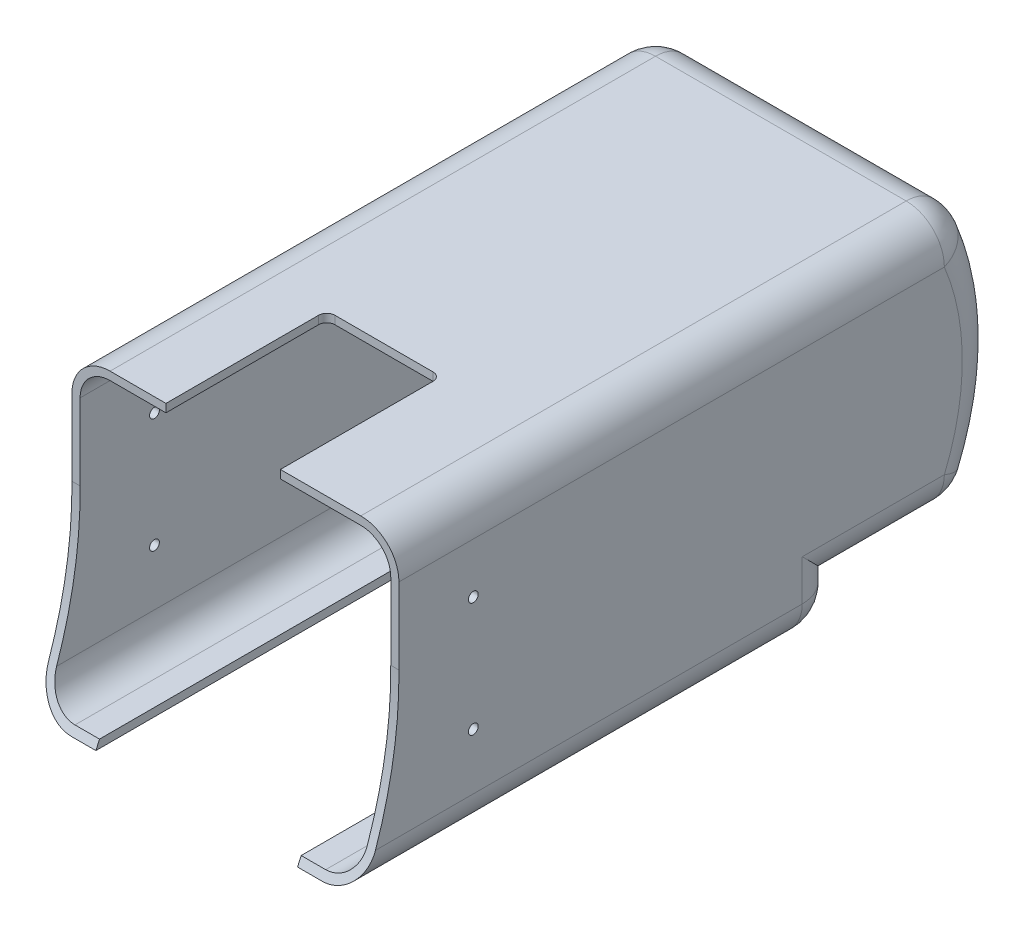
SolidWorks part; units mm, degrees
ref_plane "Front Plane" through (0, 0, 0) normal (0, 0, 1) x (1, 0, 0)
ref_plane "Top Plane" through (0, 0, 0) normal (0, 1, 0) x (1, 0, 0)
ref_plane "Right Plane" through (0, 0, 0) normal (1, 0, 0) x (0, 0, -1)
sketch "Sketch1" plane through (0, 0, 0) normal (0, 0, 1) x (1, 0, 0)
  line L3 (60, -54.5) -> (60, 54.5)
  line L4 (60, 54.5) -> (-60, 54.5)
  line L5 (-60, 54.5) -> (-60, -54.5)
  line L7 (-60, -54.5) -> (60, -54.5)
  line L8 (0, 0) -> (0, 54.5) construction
  line L9 (0, 0) -> (60, 0) construction
  dimension "D1" = 120
  dimension "D2" = 109
extrude "Boss-Extrude1" add sketch "Sketch1" against normal blind 193
sketch "Sketch11" plane through (60, 0, 0) normal (1, 0, 0) x (0, 0, -1)
  line L0 (0, 54.5) -> (-24.1876, 54.5)
  line L1 (0, -54.5) -> (-32.417, -54.5)
  line L4 (193, -54.5) -> (0, -54.5) construction
  line L7 (0, 54.5) -> (0, -54.5)
  line L8 (0, -54.5) -> (193, -54.5)
  line L9 (193, -54.5) -> (193, 54.5)
  line L10 (193, 54.5) -> (0, 54.5)
  line L11 (0, 54.5) -> (0, -54.5)
  arc A1 (-27.3008, -32.4552) -> (-27.3008, 54.4552) centre (-174, 11) ccw construction
  arc A2 (-32.417, -54.5) -> (-24.1876, 54.5) centre (-174, 11) ccw
  arc A3 (-24.4244, -33.3073) -> (-24.4244, 55.3073) centre (-174, 11) ccw construction
  dimension "D1" = 3
  dimension "D3" = 174
  dimension "D4" = 156
  dimension "D5" = 43.5
  dimension "D2" = 0
extrude "Boss-Extrude4" add sketch "Sketch11" against normal up to surface (120 mm away) contours L1 A2 L0 L11
sketch "Sketch2" plane through (60, 0, 0) normal (1, 0, 0) x (0, 0, -1)
  line L0 (193, -39.5) -> (146, -39.5)
  line L1 (193, -54.5) -> (193, 54.5) construction
  line L2 (146, -39.5) -> (146, -54.5)
  line L3 (193, -54.5) -> (-32.417, -54.5) construction
  line L4 (193, -39.5) -> (193, -54.5)
  line L5 (193, -54.5) -> (146, -54.5)
  dimension "D1" = 15
  dimension "D2" = 47
extrude "Cut-Extrude1" cut sketch "Sketch2" against normal through all
sketch "Sketch10" plane through (60, 0, 0) normal (1, 0, 0) x (0, 0, -1)
  line L1 (193, -39.5) -> (193, 54.5) construction
  line L2 (193, -39.5) -> (193, 54.5)
  arc A0 (193, 54.5) -> (193, -39.5) centre (104.7334, 7.5) cw
  dimension "D1" = 100
extrude "Boss-Extrude3" add sketch "Sketch10" against normal up to surface (120 mm away)
fillet "Fillet1" radius 14 13 edges at (60, -54.5, -56.7915) (-60, -54.5, -56.7915) (-60, 54.5, -84.4062) (60, 54.5, -84.4062) (60, -47, -146) (-60, -47, -146) (60, -39.5, -169.5) (-60, -39.5, -169.5) (0, -54.5, -146) (0, 54.5, -193) (-60, 7.5, -204.7334) (60, 7.5, -204.7334) (0, -39.5, -193)
shell "Shell1" thickness 3
sketch "Sketch8" plane through (0, -54.5, 0) normal (0, -1, 0) x (1, 0, 0)
  line L0 (-46, 32.417) -> (46, 32.417) construction
  line L1 (-37, 32.417) -> (37, 32.417)
  line L2 (-37, 32.417) -> (-37, -144)
  line L3 (-37, -144) -> (37, -144)
  line L4 (37, 32.417) -> (37, -144)
  line L5 (0, -146) -> (0, -144) construction
  line L6 (-46, -146) -> (46, -146) construction
  dimension "D1" = 2
  dimension "D2" = 74
extrude "Cut-Extrude5" cut sketch "Sketch8" against normal up to next
sketch "Sketch3" plane through (0, 0, -146) normal (0, 0, -1) x (-1, 0, 0)
  line L0 (46, -39.5) -> (-46, -39.5) construction
  line L1 (-37, -36.5) -> (-37, -47.7111) construction
  line L2 (37, -36.5) -> (37, -47.7111) construction
  line L6 (37, -47.7111) -> (37, -39.5)
  line L7 (-37, -47.7111) -> (37, -47.7111) construction
  line L9 (-37, -47.7111) -> (37, -47.7111)
  line L10 (-37, -39.5) -> (-37, -47.7111)
  line L11 (37, -39.5) -> (-37, -39.5)
extrude "Cut-Extrude2" cut sketch "Sketch3" against normal blind 3
sketch "Sketch4" plane through (0, -39.5, 0) normal (0, -1, 0) x (1, 0, 0)
  line L1 (-37, -142.9545) -> (37, -142.9545)
  line L2 (-37, -142.9545) -> (-37, -147.9545)
  line L3 (-37, -147.9545) -> (37, -147.9545)
  line L4 (37, -142.9545) -> (37, -147.9545)
  line L5 (37, -132) -> (37, 32.417) construction
  line L6 (37, -142.9545) -> (-37, -142.9545) construction
  dimension "D1" = 5
extrude "Cut-Extrude3" cut sketch "Sketch4" against normal blind 3
sketch "Sketch5" plane through (0, 54.5, 0) normal (0, 1, 0) x (1, 0, 0)
  line L0 (-25.5, -24.1876) -> (-25.5, 40)
  line L2 (-22.5, 43) -> (13.5, 43)
  line L3 (16.5, 40) -> (16.5, -24.1876)
  line L4 (60, 184.15) -> (60, -20.8147) construction
  line L5 (-46, -24.1876) -> (46, -24.1876) construction
  line L7 (-25.5, -24.1876) -> (16.5, -24.1876)
  arc A0 (13.5, 43) -> (16.5, 40) centre (13.5, 40) cw
  arc A1 (-25.5, 40) -> (-22.5, 43) centre (-22.5, 40) cw
  point P10 (16.5, 43)
  point P13 (-25.5, 43)
  dimension "D4" = 3
  dimension "D1" = 42
  dimension "D2" = 43.5
  dimension "D3" = 67.1876
extrude "Cut-Extrude4" cut sketch "Sketch5" against normal blind 5
hole_wizard "M3 Clearance Hole1" positions "Sketch7" profile "Sketch6" hole size "M3" standard "ANSI Metric"
sketch "Sketch7" plane through (-60, 0, 0) normal (-1, 0, 0) x (0, 0, 1)
  line L0 (-184.15, 54.5) -> (24.1876, 54.5) construction
  line L1 (-11.286, 22.072) -> (-11.286, -19.928) construction
  point P0 (-11.286, 22.072)
  point P2 (-11.286, -19.928)
  dimension "D1" = 32.428
  dimension "D2" = 42
  dimension "D3" = 43.703
sketch "Sketch6" plane through (-60, 22.072, -11.286) normal (0, 1, 0) x (0, 0, 1)
  line L0 (0, 0) -> (0, 120)
  line L1 (0, 120) -> (1.8, 120)
  line L2 (1.8, 120) -> (1.8, 0)
  line L5 (1.8, 0) -> (0, 0)
  line L11 (0, -6.35) -> (0, 107.95) construction
  dimension "Thru Hole Dia." = 3.6
  dimension "Thru Hole Depth" = 120
sketch "Sketch12" plane through (60, 0, 0) normal (1, 0, 0) x (0, 0, -1)
  line L0 (-18.0072, 9.5001) -> (-18.0072, 54.5)
  line L1 (-24.1876, 54.5) -> (184.15, 54.5) construction
  line L2 (-18.0072, 54.5) -> (-24.1876, 54.5)
  arc A0 (-26.746, -40.5) -> (-20.8147, 40.5) centre (-174, 11) ccw construction
  arc A1 (-18.0072, 9.5001) -> (-24.1876, 54.5) centre (-184.9211, 9.5001) ccw
extrude "Cut-Extrude6" cut sketch "Sketch12" against normal through all
sketch "Sketch13" plane through (60, 0, 0) normal (1, 0, 0) x (0, 0, -1)
  line L0 (-18.0072, 12.4999) -> (-18.0072, 40.5) construction
  line L1 (-18.0072, 54.5) -> (-18.0072, 40.5) construction
  line L2 (-18.0072, 12.4999) -> (-18.0072, 40.5)
  line L3 (-18.0072, 54.5) -> (-18.0072, 40.5)
  line L4 (-16.0072, 54.5) -> (-16.0072, 40.5)
  line L5 (-16.0072, 12.5095) -> (-16.0072, 40.5)
  line L6 (132, -54.5) -> (-32.417, -54.5) construction
  line L7 (-30.2163, -54.5) -> (-32.417, -54.5)
  line L8 (-18.0072, 54.5) -> (184.15, 54.5) construction
  line L9 (-18.0072, 54.5) -> (-16.0072, 54.5)
  arc A0 (-26.746, -40.5) -> (-18.0072, 12.4999) centre (-174, 11) ccw construction
  arc A1 (-32.417, -54.5) -> (-26.746, -40.5) centre (-174, 11) ccw construction
  arc A2 (-26.746, -40.5) -> (-18.0072, 12.4999) centre (-174, 11) ccw
  arc A3 (-32.417, -54.5) -> (-26.746, -40.5) centre (-174, 11) ccw
  arc A4 (-24.8581, -41.1603) -> (-16.0072, 12.5095) centre (-174, 11) ccw
  arc A5 (-30.2163, -54.5) -> (-24.8581, -41.1603) centre (-174, 11) ccw
  arc A9 (-30.6018, -55.3397) -> (-24.8581, -41.1603) centre (-174, 11) ccw construction
  dimension "D1" = 2
extrude "Cut-Extrude7" cut sketch "Sketch13" against normal through all
